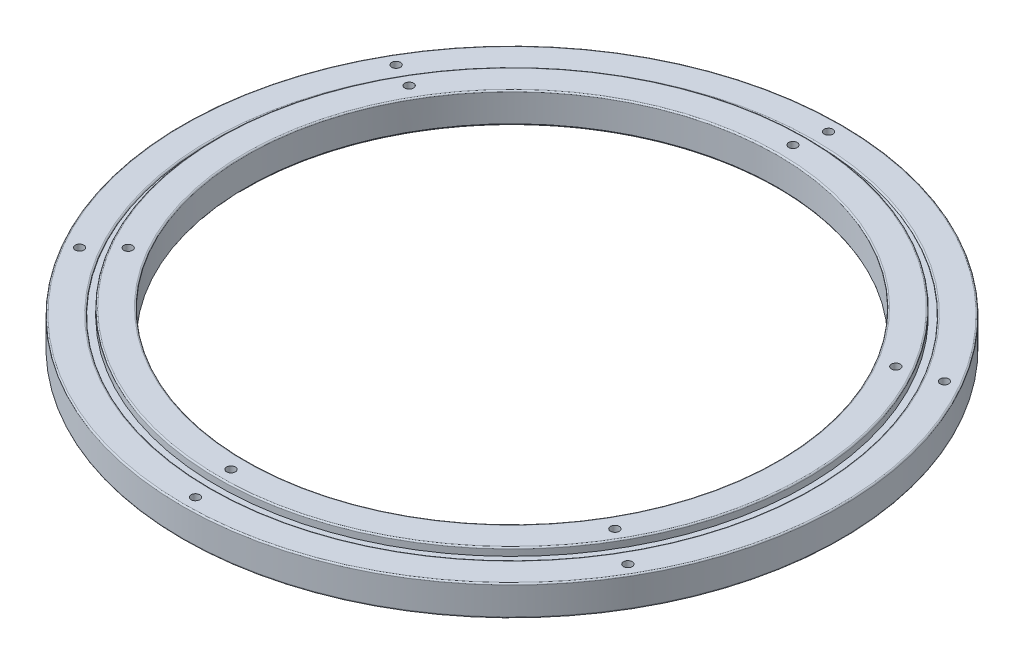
SolidWorks part; units mm, degrees
ref_plane "Front" through (0, 0, 0) normal (0, 0, 1) x (1, 0, 0)
ref_plane "Top" through (0, 0, 0) normal (0, 1, 0) x (1, 0, 0)
ref_plane "Right" through (0, 0, 0) normal (1, 0, 0) x (0, 0, -1)
sketch "Sketch1" plane through (0, 0, 0) normal (0, 0, 1) x (1, 0, 0)
  line L0 (0, 0) -> (0, 16.9) construction
  line L1 (-122.5169, 16.9) -> (-135.7775, 16.9)
  line L2 (-138.7493, 14) -> (-152.01, 14)
  line L3 (-152.01, 14) -> (-152.01, 0)
  line L4 (-152.01, 0) -> (-138.7493, 0)
  line L5 (-135.7775, 2.9) -> (-122.5169, 2.9)
  line L6 (-122.5169, 2.9) -> (-122.5169, 16.9)
  line L7 (-138.7493, 14) -> (-138.7493, 13.365)
  line L8 (-138.7493, 13.365) -> (-135.7775, 13.365)
  line L9 (-135.7775, 13.365) -> (-135.7775, 16.9)
  line L10 (-135.7775, 2.9) -> (-135.7775, 3.535)
  line L11 (-135.7775, 3.535) -> (-138.7493, 3.535)
  line L12 (-138.7493, 3.535) -> (-138.7493, 0)
  dimension "D4" = 14
  dimension "D1" = 14
  dimension "D2" = 304.02
  dimension "D3" = 245.0338
  dimension "D5" = 29.4931
  dimension "D6" = 16.9
  dimension "D7" = 2.9718
  dimension "D8" = 0.635
revolve "Revolve1" add sketch "Sketch1" angle 360 about L0
fillet "Fillet1" radius 0.635 8 edges at (0, 2.9, -122.5169) (0, 16.9, -122.5169) (0, 14, -152.01) (0, 0, -152.01) (0, 16.9, -135.7775) (0, 2.9, -135.7775) (0, 0, -138.7493) (0, 14, -138.7493)
hole_wizard "Ø4.0 (4) Diameter Hole1" positions "Sketch2" profile "Sketch3" hole size "Ø4.0" standard "ANSI Metric"
sketch "Sketch2" plane through (0, 16.9, 0) normal (0, 1, 0) x (1, 0, 0)
  line L2 (0, -137.2634) -> (0, -122.5169) construction
  line L4 (0, -137.2634) -> (0, -152.01) construction
  circle A0 centre (0, 0) radius 122.5169 construction
  circle A2 centre (0, 0) radius 152.01 construction
  point P0 (0, -146.0119)
  point P2 (0, -129.6035)
  dimension "D1" = 129.6035
  dimension "D2" = 146.0119
sketch "Sketch3" plane through (0, 16.9, 146.0119) normal (1, 0, 0) x (0, 0, 1)
  line L0 (0, 0) -> (0, 16.9)
  line L1 (0, 16.9) -> (2, 16.9)
  line L2 (2, 16.9) -> (2, 0)
  line L5 (2, 0) -> (0, 0)
  line L11 (0, -6.35) -> (0, 107.95) construction
  dimension "Thru Hole Dia." = 4
  dimension "Thru Hole Depth" = 16.9
pattern_circular "CirPattern1" count 6 over 360 about axis through (0, 0, 0) along (0, 1, 0) of "Ø4.0 (4) Diameter Hole1"
